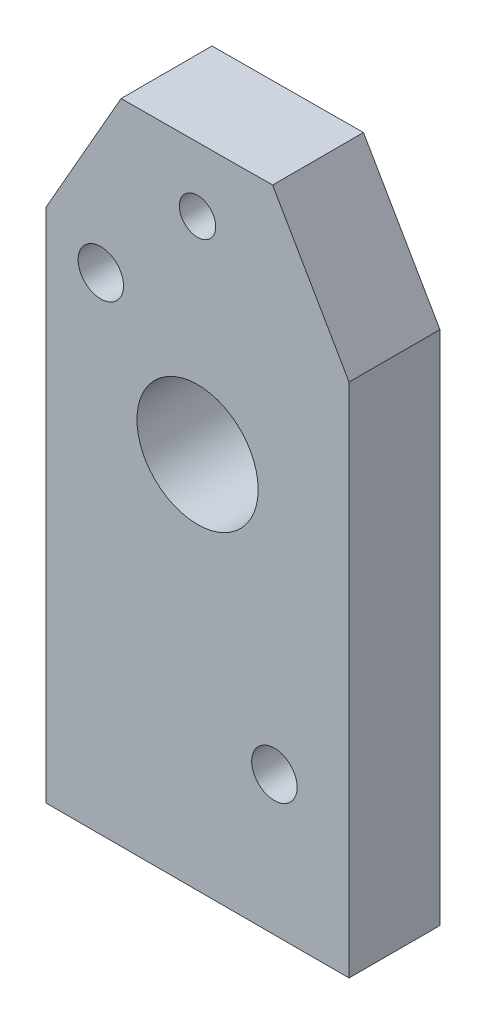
SolidWorks part; units mm, degrees
ref_plane "Front Plane" through (0, 0, 0) normal (0, 0, 1) x (1, 0, 0)
ref_plane "Top Plane" through (0, 0, 0) normal (0, 1, 0) x (1, 0, 0)
ref_plane "Right Plane" through (0, 0, 0) normal (1, 0, 0) x (0, 0, -1)
sketch "Sketch1" plane through (0, 0, 0) normal (0, 0, 1) x (1, 0, 0)
  line L0 (16.2661, 76.0674) -> (11.2195, 84.8082)
  line L1 (11.2195, 84.8082) -> (1.2195, 84.7545)
  line L2 (1.2195, 84.7545) -> (-3.7339, 76.0674)
  line L3 (-3.7339, 76.0674) -> (-3.7339, 42.0024)
  line L4 (-3.7339, 42.0024) -> (16.2661, 42.0024)
  line L5 (16.2661, 42.0024) -> (16.2661, 76.0674)
  circle A0 centre (11.3399, 51.182) radius 1.5
  circle A1 centre (-0.1201, 74.1211) radius 1.5
  circle A2 centre (6.2661, 66.9261) radius 4
extrude "Boss-Extrude1" add sketch "Sketch1" along normal blind 6
sketch "Sketch2" plane through (0, 0, 6) normal (0, 0, 1) x (1, 0, 0)
  circle A0 centre (6.2661, 80.5424) radius 1.2
extrude "Cut-Extrude1" cut sketch "Sketch2" against normal blind 6
